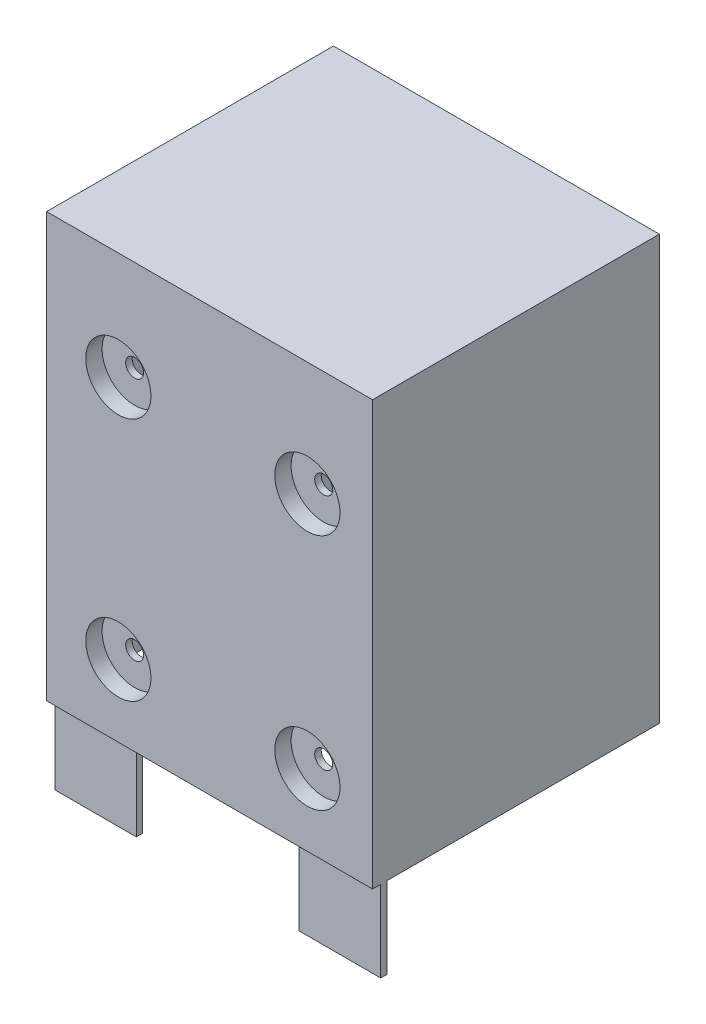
SolidWorks part; units mm, degrees
ref_plane "Front Plane" through (0, 0, 0) normal (0, 0, 1) x (1, 0, 0)
ref_plane "Top Plane" through (0, 0, 0) normal (0, 1, 0) x (1, 0, 0)
ref_plane "Right Plane" through (0, 0, 0) normal (1, 0, 0) x (0, 0, -1)
body saved out of another part "Stock-New base-1"
sketch "Sketch1" plane through (0, 0, 0) normal (0, -1, 0) x (1, 0, 0)
  line L0 (0, 88) -> (0, 81) construction
  line L1 (0, 85.5) -> (25, 85.5)
  line L2 (0, 85.5) -> (0, 83.6)
  line L3 (0, 83.6) -> (25, 83.6)
  line L4 (25, 85.5) -> (25, 83.6)
  line L5 (100, 88) -> (100, 0) construction
  line L6 (100, 85.5) -> (75, 85.5)
  line L7 (100, 85.5) -> (100, 83.6)
  line L8 (100, 83.6) -> (75, 83.6)
  line L9 (75, 85.5) -> (75, 83.6)
  line L10 (100, 88) -> (0, 88) construction
  dimension "D1" = 1.9
  dimension "D2" = 1.9
  dimension "D3" = 25
  dimension "D4" = 25
  dimension "D5" = 2.5
  dimension "D6" = 2.5
extrude "Boss-Extrude1" add sketch "Sketch1" along normal blind 24.9
fillet "Fillet2" radius 1 2 edges at (35, 0, 1.5) (65, 0, 1.5)
fillet "Fillet1" radius 1.5 6 edges at (35, 16, 3) (50, 30, 3) (65, 16, 3) (35, 15.5, 0) (50, 30, 0) (65, 15.5, 0)
